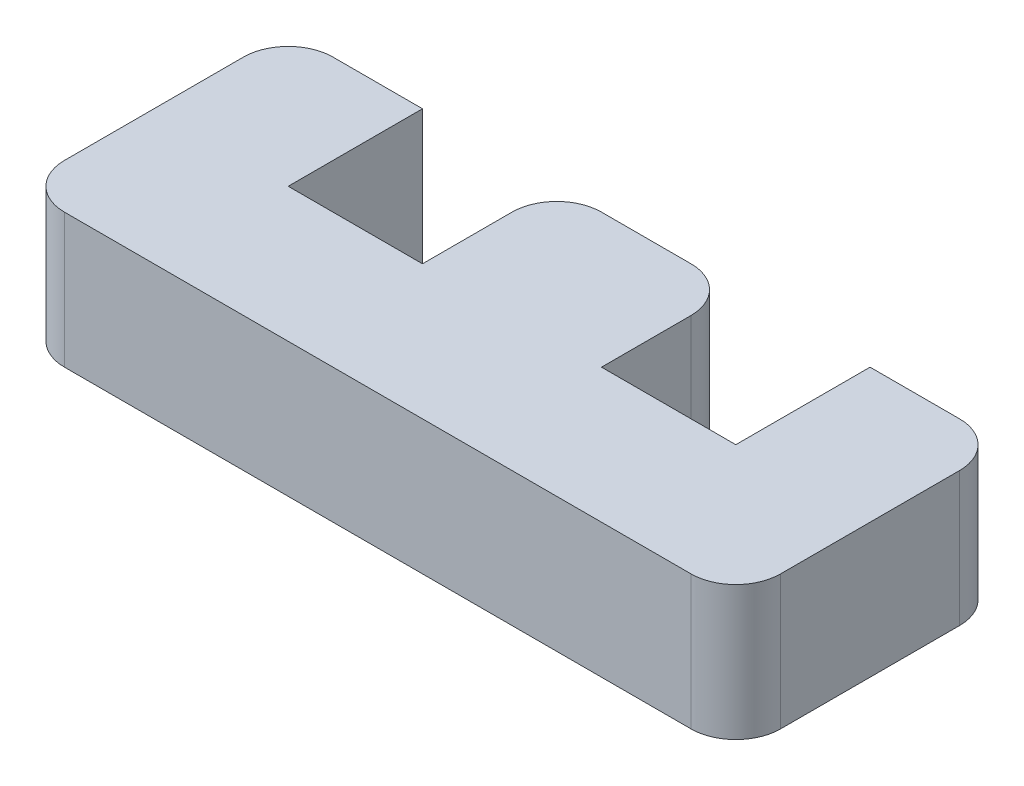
SolidWorks part; units mm, degrees
ref_plane "Front" through (0, 0, 0) normal (0, 0, 1) x (1, 0, 0)
ref_plane "Top" through (0, 0, 0) normal (0, 1, 0) x (1, 0, 0)
ref_plane "Right" through (0, 0, 0) normal (1, 0, 0) x (0, 0, -1)
sketch "草图1" plane through (0, 0, 0) normal (0, 1, 0) x (1, 0, 0)
  line L0 (0, 0) -> (0, -6)
  line L1 (0, -6) -> (16, -6)
  line L2 (16, -6) -> (16, 0)
  line L3 (16, 0) -> (13, 0)
  line L4 (13, 0) -> (13, -3)
  line L5 (13, -3) -> (10, -3)
  line L6 (10, -3) -> (10, 0)
  line L7 (10, 0) -> (6, 0)
  line L8 (6, 0) -> (6, -3)
  line L9 (6, -3) -> (3, -3)
  line L10 (3, -3) -> (3, 0)
  line L11 (3, 0) -> (0, 0)
  dimension "D1" = 16
  dimension "D2" = 4
  dimension "D3" = 3
  dimension "D4" = 3
  dimension "D5" = 3
  dimension "D6" = 6
  dimension "D7" = 3
  dimension "D8" = 3
extrude "凸台-拉伸1" add sketch "草图1" along normal blind 3
fillet "圆角1" radius 1 6 edges at (10, 1.5, 0) (6, 1.5, 0) (0, 1.5, 0) (16, 1.5, 0) (16, 1.5, 6) (0, 1.5, 6)
